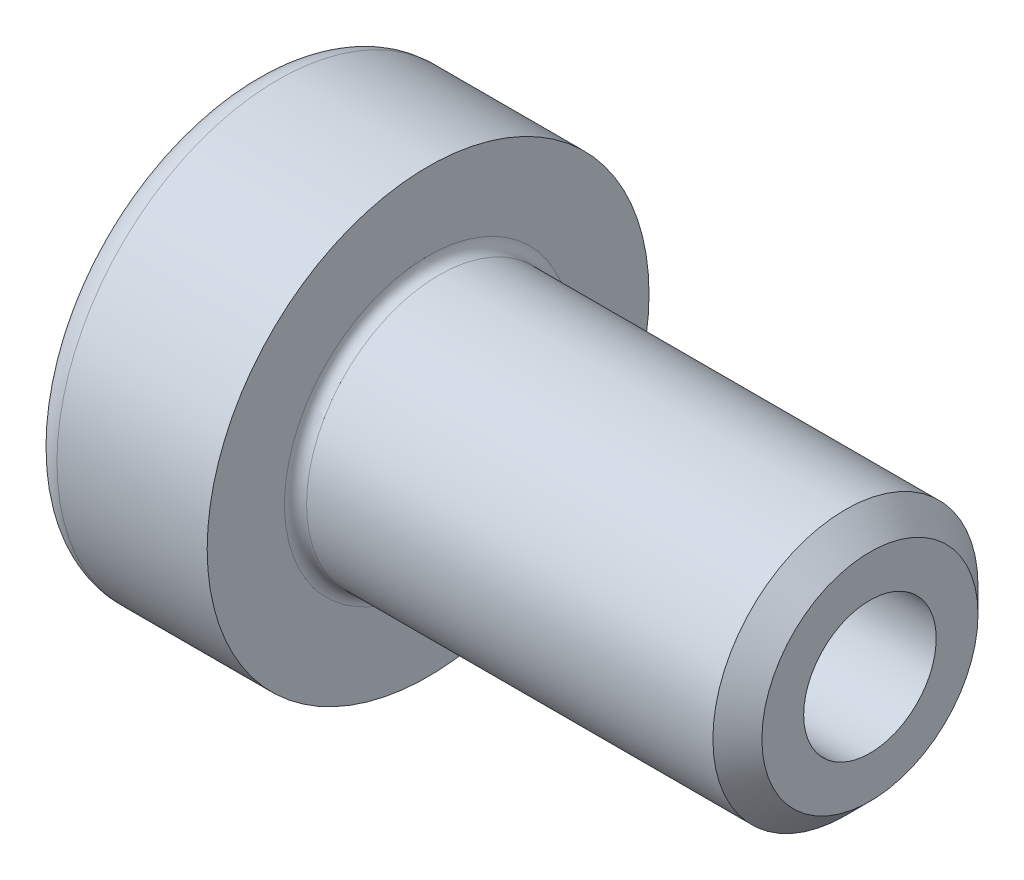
SolidWorks part; units mm, degrees
revolve "Base-Revolve" add sketch "BodySke"
sketch "BodySke" plane through (0, 0, 0) normal (0, 0, 1) x (1, 0, 0)
  line L0 (0, 0) -> (0, 5)
  line L1 (0, 5) -> (4, 5)
  line L2 (4, 5) -> (4, 3)
  line L3 (4, 3) -> (13.4455, 3)
  line L4 (14, 2.4455) -> (14, 0)
  line L5 (14, 0) -> (0, 0)
  line L6 (-31.75, 0) -> (127, 0) construction
  line L8 (14, 2.4455) -> (13.4455, 3)
  line L10 (14, -2.4455) -> (13.4455, -3) construction
  line L11 (5, 4.525) -> (5, -1.825) construction
  line L12 (4, 4.525) -> (4, -1.825) construction
  line L13 (-46, 4.525) -> (-46, -1.825) construction
fillet "Fillet1" radius 0.25 1 edges at (4, 0, 3)
fillet "Fillet2" radius 0.6 1 edges at (0, 0, 5)
ref_plane "Plane1" through (0, 0, 0) normal (0, 0, 1) x (1, 0, 0)
ref_plane "Plane2" through (0, 0, 0) normal (0, 1, 0) x (1, 0, 0)
ref_plane "Plane3" through (0, 0, 0) normal (1, 0, 0) x (0, 0, -1)
sketch "HexSke" plane through (0, 0, 0) normal (-1, 0, 0) x (0, 0.5, 0.866)
  line L0 (1.4434, 2.5) -> (-1.4434, 2.5)
  line L1 (-1.4434, 2.5) -> (-2.8868, 0)
  line L2 (1.4434, 2.5) -> (2.8868, 0)
  line L3 (1.4434, -2.5) -> (2.8868, 0)
  line L4 (1.4434, -2.5) -> (-1.4434, -2.5)
  line L5 (-1.4434, -2.5) -> (-2.8868, 0)
extrude "Hex" cut sketch "HexSke" against normal blind 2.5
sketch "PilotSke" plane through (0, 0, 0) normal (0, 0, 1) x (1, 0, 0)
  line L0 (0, 2.5) -> (2.5, 2.5)
  line L1 (2.5, 2.5) -> (3.0774, 1.5)
  line L2 (-31.75, 0) -> (127, 0) construction
  line L3 (5.866, 0) -> (0, 0)
  line L4 (0, 0) -> (0, 2.5)
  line L5 (3.0774, 1.5) -> (5, 1.5)
  line L6 (0, 0) -> (47.625, 0) construction
  line L7 (5, 1.5) -> (5.866, 0)
revolve "Hex-PreBroach" cut sketch "PilotSke" angle 360 about L6
sketch "ThdSchSke" plane through (0, 0, 0) normal (0, 0, 1) x (1, 0, 0)
  line L0 (7, -2.4455) -> (6.6117, -3)
  line L1 (7, -2.4455) -> (7.3883, -3)
  line L2 (7.3883, -3) -> (7.3883, -3.75)
  line L3 (-3.175, 0) -> (5.1513, 0) construction
  line L4 (0, 4.4) -> (0, -4.4) construction
  line L5 (7.3883, -3.75) -> (6.6117, -3.75)
  line L6 (6.6117, -3.75) -> (6.6117, -3)
revolve "ThreadSchematic" [suppressed] cut sketch "ThdSchSke" angle 360 about L3
pattern_linear "ThdSchPat" [suppressed]
sketch "Sketch1" plane through (0, 0, 0) normal (-1, 0, 0) x (0, 0, 1)
  circle A0 centre (0, 0) radius 1.5
  dimension "D1" = 3
extrude "Cut-Extrude1" cut sketch "Sketch1" against normal through all
equation "\"D2@HexSke\" = \"Hex_size@HexSke\" / 2"
equation "\"D1@HexSke\" = \"Hex_size@HexSke\" / 2"
equation "\"D1@PilotSke\" = \"Hex_size@HexSke\" / 2"
equation "\"Thread_minor@ThreadCosmetic\"  =  \"Minor_dia@BodySke\""
equation "\"Depth@PilotSke\" =  \"Key_eng@Hex\""
equation "\"Thread_length@ThreadCosmetic\" = ((sgn( (\"Length@BodySke\" - \"Advance@BodySke\" * 3.0) - \"Thread_nom@BodySke\" )-1)*( (\"Length@BodySke\" - \"Advance@BodySke\" * 3.0) - \"Thread_nom@BodySke\" ))/-2+ \"Thread_no"
equation "\"Thread_minor@ThdSchSke\" = \"Minor_dia@BodySke\""
equation "\"Diameter@ThdSchSke\" = \"Diameter@BodySke\""
equation "\"Overcut@ThdSchSke\" = \"Diameter@BodySke\" * 1.25"
equation "\"Start@ThdSchSke\" = \"Head_ht@BodySke\" + \"Length@BodySke\" - \"Thread_length@ThreadCosmetic\"  '---Non-countersunk---"
equation "\"Num_threads@ThdSchPat\" = int( \"Thread_length@ThreadCosmetic\" / \"Advance@BodySke\" + 0.999 )  + 1"
equation "\"Advance@ThdSchPat\" = \"Thread_length@ThreadCosmetic\" /  (\"Num_threads@ThdSchPat\" - 1) 'relax it"
equation "\"Num_threads@ThdSchPat\" = \"Num_threads@ThdSchPat\" - sgn( \"Num_threads@ThdSchPat\" - 1) '---chamfered tips only---"
